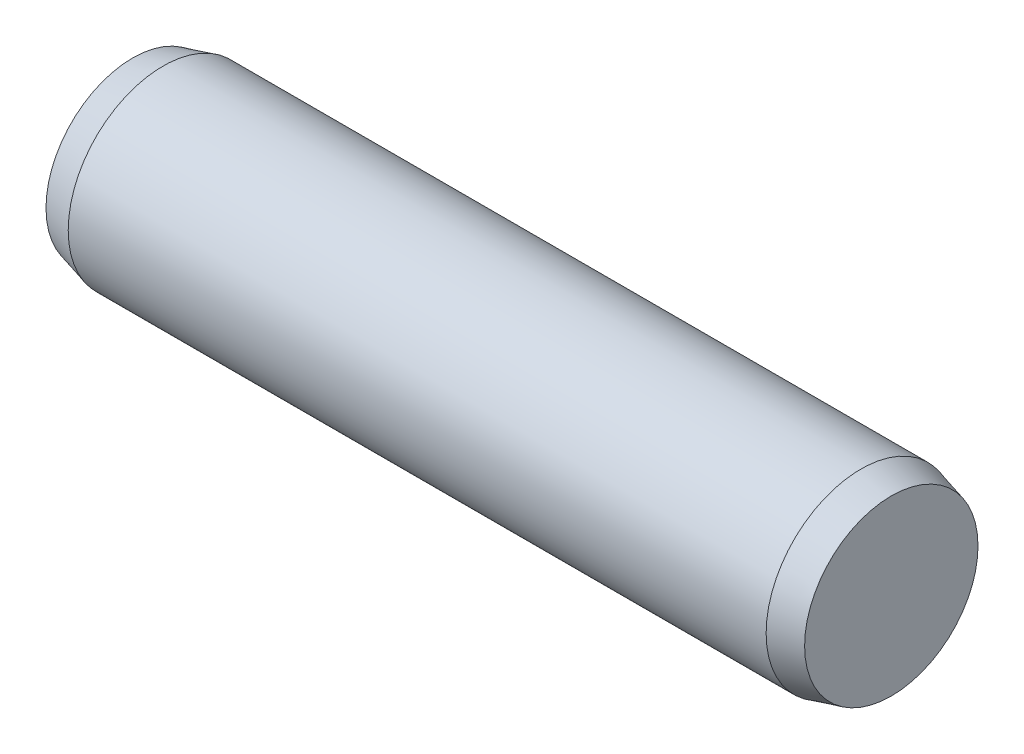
SolidWorks part; units mm, degrees
ref_plane "Front Plane" through (0, 0, 0) normal (0, 0, 1) x (1, 0, 0)
ref_plane "Top Plane" through (0, 0, 0) normal (0, 1, 0) x (1, 0, 0)
ref_plane "Right Plane" through (0, 0, 0) normal (1, 0, 0) x (0, 0, -1)
sketch "Sketch1" plane through (0, 0, 0) normal (0, 0, 1) x (1, 0, 0)
  line L0 (-4.6, 0) -> (4.6, 0) construction
  line L1 (4.6, 1.25) -> (4.6, -1.25) construction
  line L2 (-4.6, 1.25) -> (-4.6, -1.25) construction
  line L3 (5, 1.25) -> (5, -1.25) construction
  line L4 (-5, 1.25) -> (-5, -1.25) construction
  line L5 (-4.6, 0) -> (-5, 0) construction
  line L6 (4.6, 0) -> (5, 0) construction
  dimension "D1" = 0.4
  dimension "Dia" = 2.5
  dimension "Length" = 10
  dimension "C" = 0.4
sketch "Sketch2" plane through (0, 0, 0) normal (1, 0, 0) x (0, 0, -1)
  circle A0 centre (0, 0) radius 1.25
extrude "Extrude1" add sketch "Sketch2" against normal up to vertex (4.6 mm away) and the other way up to vertex (4.6 mm away)
sketch "Sketch3" plane through (4.6, 0, 0) normal (1, 0, 0) x (0, 0, -1)
  circle A1 centre (0, 0) radius 1.25
  circle A2 centre (0, 0) radius 1.25
  dimension "D1" = 0
extrude "Extrude2" add sketch "Sketch3" along normal up to vertex (0.4 mm away) draft 15
sketch "Sketch4" plane through (-4.6, 0, 0) normal (-1, 0, 0) x (0, 0, 1)
  circle A1 centre (0, 0) radius 1.25
  circle A2 centre (0, 0) radius 1.25
  dimension "D1" = 0
extrude "Extrude3" add sketch "Sketch4" along normal up to vertex (0.4 mm away) draft 15
equation "\"D1@Sketch1\" = \"C@Sketch1\""
